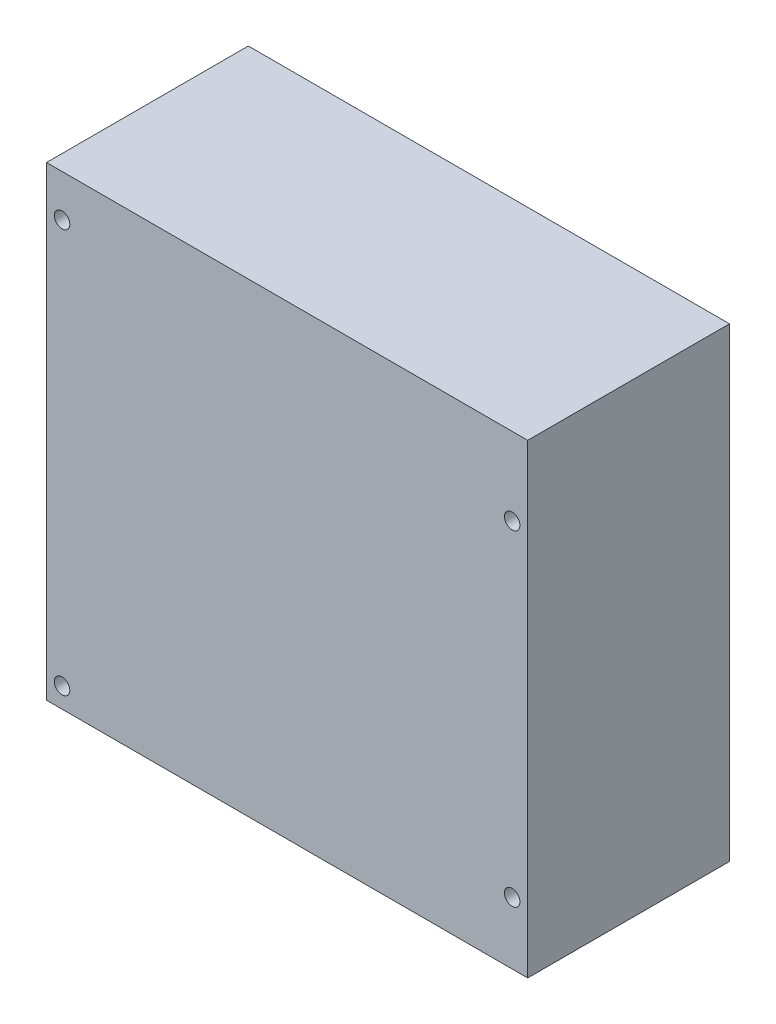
SolidWorks part; units mm, degrees
ref_plane "Front Plane" through (0, 0, 0) normal (0, 0, 1) x (1, 0, 0)
ref_plane "Top Plane" through (0, 0, 0) normal (0, 1, 0) x (1, 0, 0)
ref_plane "Right Plane" through (0, 0, 0) normal (1, 0, 0) x (0, 0, -1)
sketch "Sketch1" plane through (0, 0, 0) normal (0, 0, 1) x (1, 0, 0)
  line L2 (-39.37, -38.1) -> (39.37, -38.1)
  line L3 (-39.37, -38.1) -> (-39.37, 38.1)
  line L4 (-39.37, 38.1) -> (39.37, 38.1)
  line L5 (39.37, -38.1) -> (39.37, 38.1)
  line L6 (-39.37, -38.1) -> (39.37, 38.1) construction
  line L7 (-39.37, 38.1) -> (39.37, -38.1) construction
  circle A0 centre (36.83, 25.4) radius 1.27
  circle A1 centre (36.83, -27.94) radius 1.27
  circle A2 centre (-36.83, 31.242) radius 1.27
  circle A3 centre (-36.83, -34.798) radius 1.27
  point P2 (0, 0)
  dimension "D5" = 2.54
  dimension "D6" = 2.54
  dimension "D7" = 2.54
  dimension "D11" = 2.54
  dimension "D12" = 2.54
  dimension "D13" = 53.34
  dimension "D1" = 78.74
  dimension "D2" = 76.2
  dimension "D3" = 10.16
  dimension "D4" = 2.54
  dimension "D8" = 2.54
  dimension "D9" = 66.04
  dimension "D10" = 3.302
extrude "Boss-Extrude1" add sketch "Sketch1" along normal blind 33.02
sketch "Sketch2" plane through (0, 0, 0) normal (0, 0, -1) x (-1, 0, 0)
  circle A0 centre (-36.83, 25.4) radius 1.27
  circle A1 centre (36.83, 31.242) radius 1.27
  circle A2 centre (36.83, -34.798) radius 1.27
  circle A3 centre (36.83, -34.798) radius 1.27
  circle A4 centre (-36.83, -27.94) radius 1.27
extrude "Boss-Extrude2" add sketch "Sketch2" against normal blind 2.54 contours A0
sketch "Sketch3" plane through (0, 0, 0) normal (0, 0, -1) x (-1, 0, 0)
  circle A0 centre (36.83, 31.242) radius 1.27
  circle A1 centre (36.83, -34.798) radius 1.27
  circle A2 centre (-36.83, -27.94) radius 1.27
extrude "Boss-Extrude3" add sketch "Sketch3" against normal blind 2.54
equation "\"Uno32\"= 1.3"
equation "\"D1@Boss-Extrude1\"=\"Uno32\""
